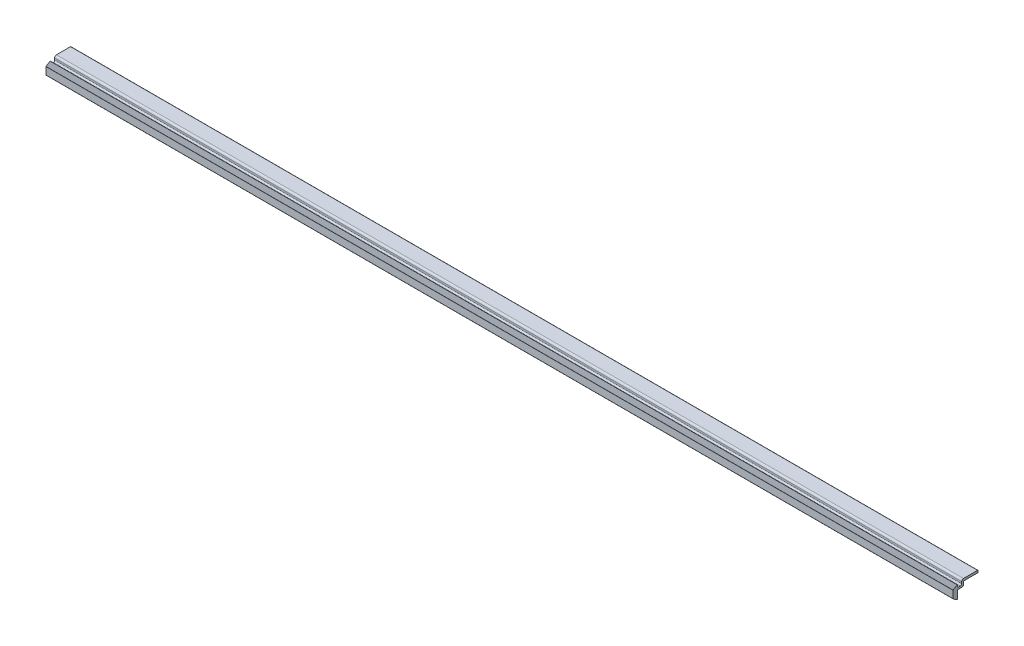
SolidWorks part; units mm, degrees
ref_plane "Ebene vorne" through (0, 0, 0) normal (0, 0, 1) x (1, 0, 0)
ref_plane "Ebene oben" through (0, 0, 0) normal (0, 1, 0) x (1, 0, 0)
ref_plane "Ebene rechts" through (0, 0, 0) normal (1, 0, 0) x (0, 0, -1)
sketch "Skizze1" plane through (0, 0, 0) normal (0, 1, 0) x (1, 0, 0)
  line L0 (0, 0) -> (1000, 0)
  dimension "D1" = 1000
other "Strukturbauteil1"
ref_plane "Ebene1" through (0, 0, 0) normal (1, 0, 0) x (0, -1, 0)
sketch "Model" plane through (0, 0, 0) normal (1, 0, 0) x (0, -1, 0)
  line L0 (-4, -5) -> (4, -5)
  line L1 (6.6, 0) -> (-1.6, 0)
  line L2 (-2.1, 0.5) -> (-2.1, 5.7)
  line L3 (-2.9, 6.5) -> (-6.8, 6.5)
  line L4 (-7.1, 6.8) -> (-7.1, 22)
  line L5 (-7.6, 22.5) -> (-9.1, 22.5)
  line L6 (-9.6, 22) -> (-9.6, 6.5)
  line L7 (-7.6, 4.5) -> (-5.6, 4.5)
  line L8 (-4.1, 3) -> (-4.1, 1)
  line L9 (-5.1, 0) -> (-6.6, 0)
  line L10 (-6.6, 0) -> (6.6, 0) construction
  line L11 (-6.8797, -0.4085) -> (-6.701, -0.8493)
  line L12 (-6.701, -0.8493) -> (-6.5094, -1.2846)
  line L13 (-6.5094, -1.2846) -> (-6.3048, -1.7139)
  line L14 (-6.3048, -1.7139) -> (-6.0876, -2.137)
  line L15 (-6.0876, -2.137) -> (-5.858, -2.5535)
  line L16 (-5.858, -2.5535) -> (-5.616, -2.963)
  line L17 (-5.616, -2.963) -> (-5.362, -3.365)
  line L18 (-5.362, -3.365) -> (-5.0962, -3.7594)
  line L19 (-5.0962, -3.7594) -> (-4.8187, -4.1457)
  line L20 (-4.8187, -4.1457) -> (-4.5299, -4.5235)
  line L21 (-4.5299, -4.5235) -> (-4.23, -4.8926)
  line L22 (4.23, -4.8926) -> (4.5299, -4.5235)
  line L23 (4.5299, -4.5235) -> (4.8187, -4.1457)
  line L24 (4.8187, -4.1457) -> (5.0962, -3.7594)
  line L25 (5.0962, -3.7594) -> (5.362, -3.365)
  line L26 (5.362, -3.365) -> (5.616, -2.963)
  line L27 (5.616, -2.963) -> (5.858, -2.5535)
  line L28 (5.858, -2.5535) -> (6.0876, -2.137)
  line L29 (6.0876, -2.137) -> (6.3048, -1.7139)
  line L30 (6.3048, -1.7139) -> (6.5094, -1.2846)
  line L31 (6.5094, -1.2846) -> (6.701, -0.8493)
  line L32 (6.701, -0.8493) -> (6.8797, -0.4085)
  arc A0 (-6.6, 0) -> (-6.8797, -0.4085) centre (-6.6, -0.3) ccw
  arc A2 (-4.23, -4.8926) -> (-4, -5) centre (-4, -4.7) ccw
  arc A3 (4, -5) -> (4.23, -4.8926) centre (4, -4.7) ccw
  arc A5 (6.8797, -0.4085) -> (6.6, 0) centre (6.6, -0.3) ccw
  arc A6 (-2.1, 0.5) -> (-1.6, 0) centre (-1.6, 0.5) ccw
  arc A7 (-2.1, 5.7) -> (-2.9, 6.5) centre (-2.9, 5.7) ccw
  arc A8 (-7.1, 6.8) -> (-6.8, 6.5) centre (-6.8, 6.8) ccw
  arc A9 (-7.1, 22) -> (-7.6, 22.5) centre (-7.6, 22) ccw
  arc A10 (-9.1, 22.5) -> (-9.6, 22) centre (-9.1, 22) ccw
  arc A11 (-9.6, 6.5) -> (-7.6, 4.5) centre (-7.6, 6.5) ccw
  arc A12 (-4.1, 3) -> (-5.6, 4.5) centre (-5.6, 3) ccw
  arc A13 (-5.1, 0) -> (-4.1, 1) centre (-5.1, 1) ccw
  point P38 (4.5299, -4.5235)
  point P39 (0, 0)
  point P40 (4.8187, -4.1457)
  point P42 (5.0962, -3.7594)
  point P43 (5.362, -3.365)
  point P44 (5.616, -2.963)
  point P45 (5.858, -2.5535)
  point P46 (6.0876, -2.137)
  point P47 (6.3048, -1.7139)
  point P48 (6.5094, -1.2846)
  point P49 (6.701, -0.8493)
  point P50 (-6.701, -0.8493)
  point P51 (-6.5094, -1.2846)
  point P52 (-6.3048, -1.7139)
  point P53 (-6.0876, -2.137)
  point P54 (-5.858, -2.5535)
  point P55 (-5.616, -2.963)
  point P56 (-5.362, -3.365)
  point P57 (-5.0962, -3.7594)
  point P58 (-4.8187, -4.1457)
  point P59 (-4.5299, -4.5235)
  point P78 (0, 0)
